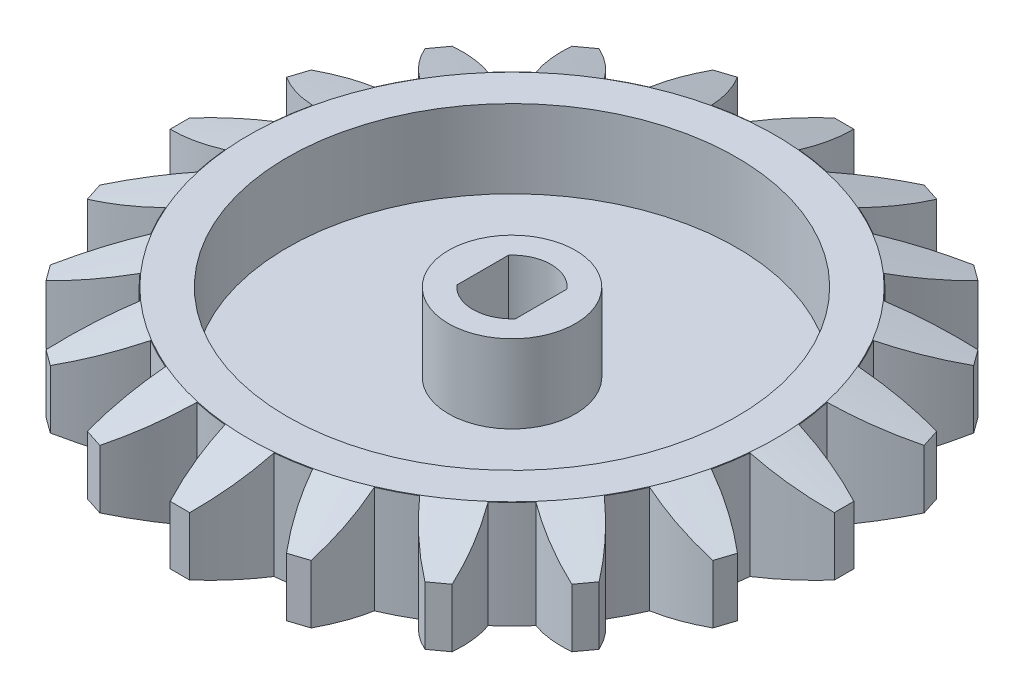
SolidWorks part; units mm, degrees
ref_plane "前视基准面" through (0, 0, 0) normal (0, 0, 1) x (1, 0, 0)
ref_plane "上视基准面" through (0, 0, 0) normal (0, 1, 0) x (1, 0, 0)
ref_plane "右视基准面" through (0, 0, 0) normal (1, 0, 0) x (0, 0, -1)
sketch "草图1" plane through (0, 0, 0) normal (0, 1, 0) x (1, 0, 0)
  circle A0 centre (0, 0) radius 13.5
  dimension "D1" = 27
extrude "凸台-拉伸1" add sketch "草图1" along normal blind 5.5
sketch "草图2" plane through (0, 0, 0) normal (0, 1, 0) x (1, 0, 0)
  line L0 (0, 13.5) -> (0, 17) construction
  line L1 (0.5, 17) -> (-0.5, 17)
  line L2 (0, 15.25) -> (-1, 15.25) construction
  line L3 (0, 13.5) -> (-1.25, 13.5) construction
  arc A0 (1.2542, 13.4416) -> (-1.2542, 13.4416) centre (0, 0) ccw
  arc A1 (-0.5, 17) -> (-1.2542, 13.4416) centre (11.875, 12.5179) ccw
  arc A2 (0.5, 17) -> (1.2542, 13.4416) centre (-11.875, 12.5179) cw
  dimension "D1" = 27
  dimension "D3" = 0.5
  dimension "D4" = 1
extrude "凸台-拉伸2" add sketch "草图2" along normal blind 5.5
sketch "草图3" plane through (0, 5.5, 0) normal (0, 1, 0) x (1, 0, 0)
  circle A0 centre (0, 0) radius 11.5
  circle A1 centre (0, 0) radius 3.25
  dimension "D1" = 6.5
  dimension "D2" = 23
extrude "切除-拉伸1" cut sketch "草图3" against normal blind 4
sketch "草图4" plane through (0, 5.5, 0) normal (0, 1, 0) x (1, 0, 0)
  line L0 (0, 2) -> (0, -2) construction
  line L1 (-1.5, 1.3229) -> (-1.5, -1.3229)
  line L2 (1.5, 1.3229) -> (1.5, -1.3229)
  line L4 (-1.5, 2) -> (-1.5, -2) construction
  line L5 (1.5, 2) -> (1.5, -2) construction
  arc A0 (-1.5, -1.3229) -> (1.5, -1.3229) centre (0, 0) ccw
  arc A1 (1.5, 1.3229) -> (-1.5, 1.3229) centre (0, 0) ccw
  dimension "D1" = 4
  dimension "D2" = 1.5
  dimension "D3" = 1.5
extrude "切除-拉伸2" cut sketch "草图4" against normal up to next
sketch "草图5" plane through (0, 0, 0) normal (0, -1, 0) x (1, 0, 0)
  circle A0 centre (0, 0) radius 2
  dimension "D1" = 4
extrude "切除-拉伸3" cut sketch "草图5" against normal blind 0.2
sketch "草图7" plane through (0, 0, 0) normal (1, 0, 0) x (0, 0, -1)
  line L0 (-0.0292, 0) -> (13.4708, 0) construction
  line L1 (-13.5, 0) -> (13.4416, 0) construction
  line L2 (13.4708, 0) -> (17.9708, 0)
  line L3 (17.9708, 0) -> (17.9708, 1.5938)
  line L4 (17.9708, 1.5938) -> (13.4708, 0)
  line L5 (17, 0) -> (17, 1.25) construction
  line L6 (17, 5.5) -> (17, 0) construction
  line L7 (-0.0292, 0) -> (-0.0292, 2.75) construction
  line L8 (-0.0292, 2.75) -> (3.2353, 2.75) construction
  line L9 (13.4708, 5.5) -> (17.9708, 5.5)
  line L10 (17.9708, 5.5) -> (17.9708, 3.9062)
  line L11 (17.9708, 3.9062) -> (13.4708, 5.5)
  dimension "D1" = 13.5
  dimension "D2" = 4.5
  dimension "D3" = 1.25
  dimension "D4" = 2.75
revolve "切除-旋转3" cut sketch "草图7" angle 360 about L7
pattern_circular "阵列(圆周)2" count 20 over 360 about axis through (0, 0, 0) along (0, 1, 0) of "凸台-拉伸2", "切除-旋转3"
ref_plane "基准面1" through (0, 2.75, 0) normal (0, -1, 0) x (-1, 0, 0)
